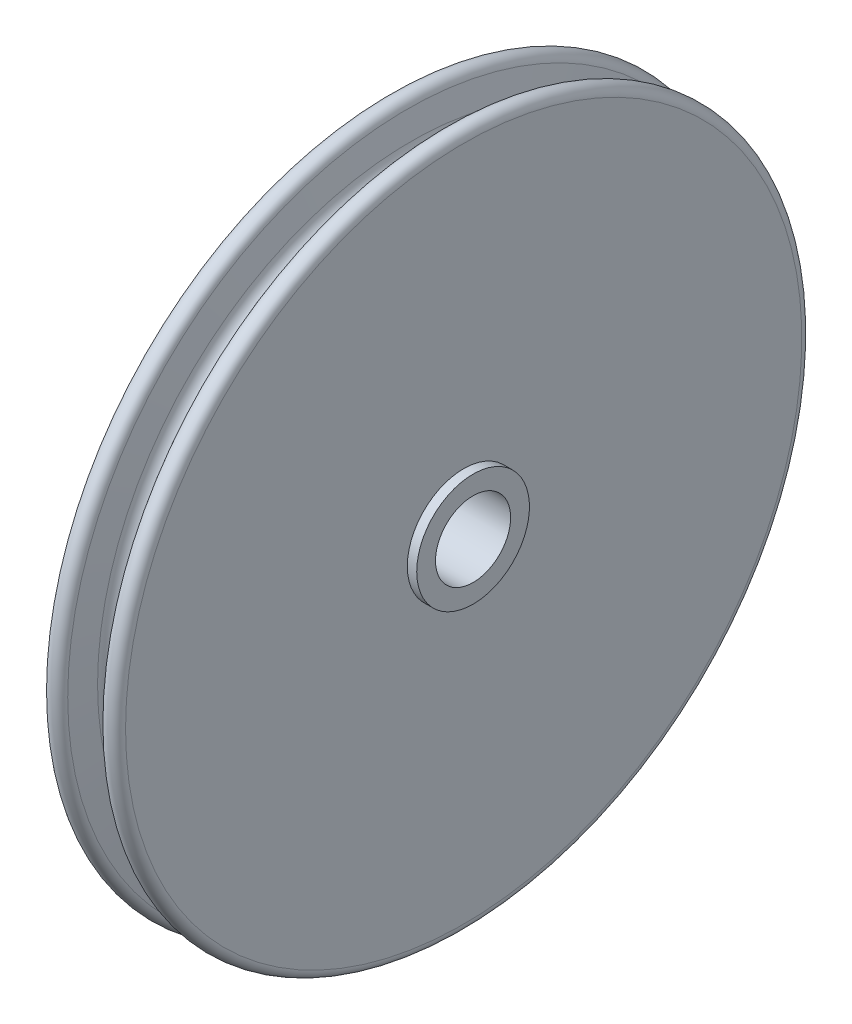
SolidWorks part; units mm, degrees
ref_plane "Plan de face" through (0, 0, 0) normal (0, 0, 1) x (1, 0, 0)
ref_plane "Plan de dessus" through (0, 0, 0) normal (0, 1, 0) x (1, 0, 0)
ref_plane "Plan de droite" through (0, 0, 0) normal (1, 0, 0) x (0, 0, -1)
sketch "Esquisse1" plane through (0, 0, 0) normal (0, 1, 0) x (1, 0, 0)
  line L0 (-12.5, 0) -> (12.5, 0) construction
  line L1 (0, 0) -> (0, 80) construction
  line L2 (12.5, 10) -> (-12.5, 10)
  line L3 (-12.5, 10) -> (-12.5, 15)
  line L4 (-12.5, 15) -> (-10, 15)
  line L5 (-10, 15) -> (-10, 90)
  line L6 (-5.0271, 90.3672) -> (-4, 83.4499)
  line L7 (5.0271, 90.3672) -> (4, 83.4499)
  line L8 (10, 15) -> (10, 90)
  line L9 (12.5, 15) -> (10, 15)
  line L10 (12.5, 10) -> (12.5, 15)
  arc A0 (-10, 90) -> (-5.0271, 90.3672) centre (-7.5, 90) cw
  arc A1 (-4, 83.4499) -> (4, 83.4499) centre (0, 84.0439) ccw
  arc A2 (10, 90) -> (5.0271, 90.3672) centre (7.5, 90) ccw
  point P21 (0, 10)
  dimension "D7" = 180
  dimension "D8" = 2.5
  dimension "D1" = 20
  dimension "D2" = 25
  dimension "D3" = 20
  dimension "D4" = 5
  dimension "D5" = 160
  dimension "D6" = 8
revolve "Révolution1" add sketch "Esquisse1" angle 360 about L0
